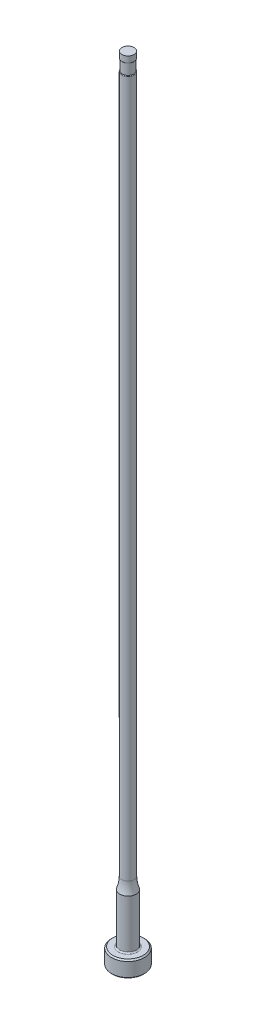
SolidWorks part; units mm, degrees
ref_plane "Front Plane" through (0, 0, 0) normal (0, 0, 1) x (1, 0, 0)
ref_plane "Top Plane" through (0, 0, 0) normal (0, 1, 0) x (1, 0, 0)
ref_plane "Right Plane" through (0, 0, 0) normal (1, 0, 0) x (0, 0, -1)
other "Configuration Table"
sketch "Sketch1" plane through (0, 0, 0) normal (0, 0, 1) x (1, 0, 0)
  line L0 (0, 259.9588) -> (0, -15.1925) construction
  line L1 (0, 0) -> (-3.175, 0)
  line L2 (-3.175, 0) -> (-3.175, 3.175)
  line L3 (-3.175, 3.175) -> (-1.5875, 3.175)
  line L4 (-1.19, 14.9114) -> (-1.19, 152.4)
  line L5 (-1.19, 152.4) -> (0, 152.4)
  line L6 (0, 152.4) -> (0, 0)
  line L7 (-1.5875, 3.175) -> (-1.5875, 12.7)
  arc A1 (-1.5875, 12.7) -> (-1.19, 14.9114) centre (-7.54, 14.9114) ccw
  dimension "D1" = 6.35
  dimension "L" = 152.4
  dimension "D2" = 3.175
  dimension "H" = 6.35
  dimension "T" = 3.175
  dimension "D" = 2.38
  dimension "S" = 12.7
revolve "Revolve1" add sketch "Sketch1" angle 360 about L0
chamfer "Chamfer1" distance 0.254 angle 45 2 edges at (0, 3.175, 3.175) (0, 0, 3.175)
fillet "Fillet1" radius 0.254 1 edges at (0, 3.175, 1.5875)
sketch "Sketch2" plane through (0, 0, 0) normal (0, 0, 1) x (1, 0, 0)
  line L0 (-1.19, 152.4) -> (-1.19, 14.9114) construction
  line L1 (-1.19, 151.13) -> (-1.0884, 151.13)
  line L2 (-1.19, 151.13) -> (-1.19, 149.098)
  line L3 (-1.19, 149.098) -> (-1.0884, 149.098)
  line L4 (-1.0884, 151.13) -> (-1.0884, 149.098)
  line L5 (1.19, 152.4) -> (-1.19, 152.4) construction
  line L6 (0, 153.4483) -> (0, 147.3282) construction
  dimension "D1" = 2.032
  dimension "N" = 1.27
  dimension "FD" = 0.1016
  dimension "D3" = 2.1768
revolve "Vent Relief" cut sketch "Sketch2" angle 360 about L6
sketch "Sketch3" plane through (0, 0, 0) normal (0, 0, 1) x (1, 0, 0)
  line L0 (-1.0884, 150.114) -> (-1.0884, 112.014)
  line L1 (-1.0884, 151.13) -> (-1.0884, 149.098) construction
  line L2 (-1.19, 149.098) -> (-1.19, 14.9114) construction
  line L3 (-1.19, 111.2172) -> (-1.19, 150.114)
  line L4 (-1.19, 150.114) -> (-1.0884, 150.114)
  arc A0 (-1.0884, 112.014) -> (-1.19, 111.2172) centre (-4.2634, 112.014) cw
  dimension "D1" = 3.175
  dimension "D2" = 38.1
extrude "D-Slot" cut sketch "Sketch3" against normal through all both and the other way through all
sketch "Sketch5" plane through (0, 0, 0) normal (0, 0, 1) x (1, 0, 0)
  line L0 (-1.19, 151.13) -> (1.19, 151.13) construction
  line L1 (-1.19, 152.4) -> (-1.1709, 152.4)
  line L2 (-1.19, 152.4) -> (-1.19, 151.13)
  line L3 (-1.19, 151.13) -> (-1.1709, 151.13)
  line L4 (-1.1709, 152.4) -> (-1.1709, 151.13)
  line L5 (0, 152.6877) -> (0, 150.5771) construction
  dimension "VP" = 0.019
revolve "Vent Diameter" cut sketch "Sketch5" angle 360 about L5
fillet "Fillet2" radius 0.127 2 edges at (1.19, 149.098, 0) (0, 151.13, 1.1709)
sketch "Pocket Sketch" plane through (0, 0, 0) normal (0, 0, 1) x (1, 0, 0)
  line L0 (-3.5719, 0) -> (-3.5719, 3.2004)
  line L1 (-3.5719, 3.2004) -> (-2.1504, 3.2004)
  line L2 (-1.3884, 3.9624) -> (-1.3884, 22.225)
  line L3 (-1.3884, 22.225) -> (0, 22.225)
  line L4 (0, 22.225) -> (0, 0)
  line L5 (0, 0) -> (-3.5719, 0)
  line L6 (0, 12.6104) -> (0, -2.4989) construction
  line L7 (-3.175, 2.921) -> (-3.175, 0.254) construction
  line L8 (2.921, 3.175) -> (-2.921, 3.175) construction
  line L9 (-1.19, 111.2172) -> (-1.19, 14.9114) construction
  line L10 (-2.1504, 3.2004) -> (-1.3884, 3.9624)
  point P3 (-1.3884, 3.2004)
  dimension "D1" = 7.1437
  dimension "D2" = 0.3969
  dimension "D3" = 0.0254
  dimension "D4" = 0.1984
  dimension "D5" = 2.7769
  dimension "D6" = 22.225
